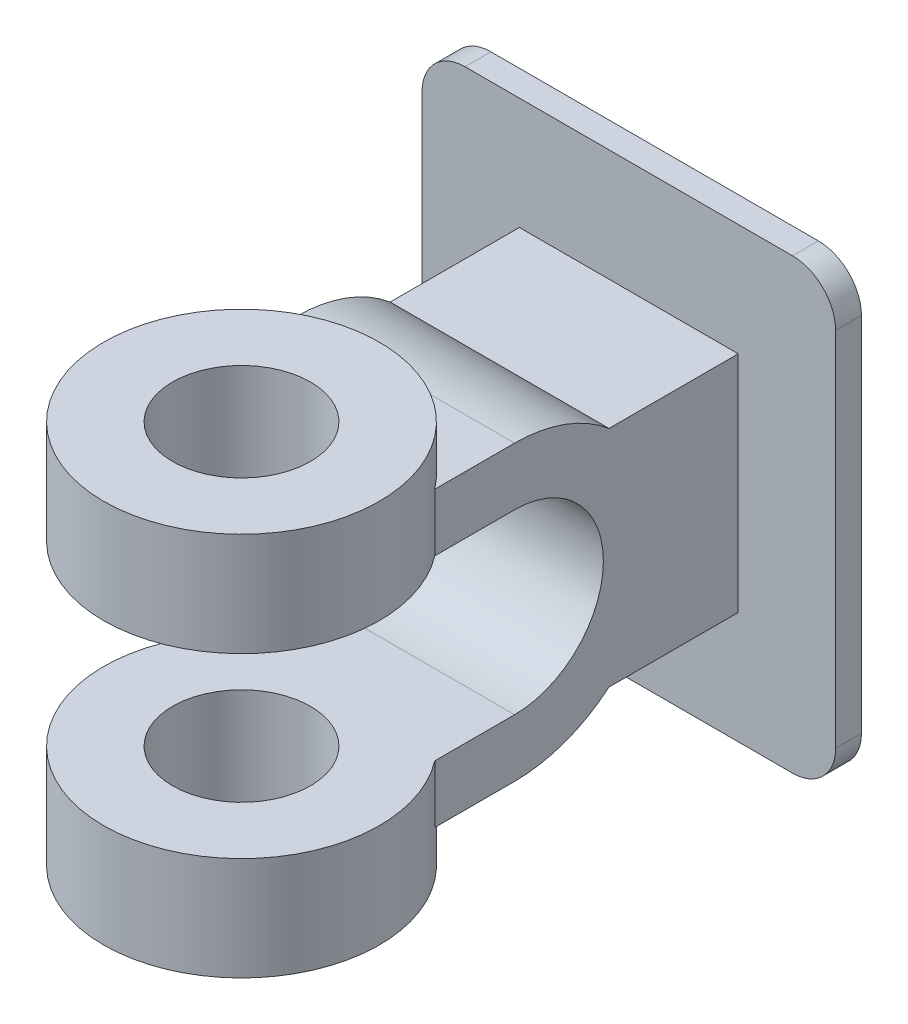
SolidWorks part; units mm, degrees
ref_plane "Front Plane" through (0, 0, 0) normal (0, 0, 1) x (1, 0, 0)
ref_plane "Top Plane" through (0, 0, 0) normal (0, 1, 0) x (1, 0, 0)
ref_plane "Right Plane" through (0, 0, 0) normal (1, 0, 0) x (0, 0, -1)
sketch "Sketch1" plane through (0, 0, 0) normal (1, 0, 0) x (0, 0, -1)
  line L0 (-19, 10.3) -> (-19, -17) construction
  line L1 (10.9545, 13) -> (25.9545, 13)
  line L3 (10.9545, -13) -> (25.9545, -13)
  line L4 (25.9545, 13) -> (25.9545, -13)
  line L5 (0, 17) -> (-19, 17)
  line L9 (25.9545, 2) -> (26.6958, 2) construction
  line L10 (0, -17) -> (-19, -17)
  line L11 (0, 10.3) -> (-19, 10.3)
  line L12 (-19, 10.3) -> (-19, 17)
  line L13 (0, -10.3) -> (-19, -10.3)
  line L14 (-19, -10.3) -> (-19, -17)
  line L15 (0, 0) -> (25.9545, 0) construction
  arc A1 (0, -10.3) -> (0, 10.3) centre (0, 0) ccw
  arc A2 (0, -17) -> (10.9545, -13) centre (0, 0) ccw
  arc A3 (10.9545, 13) -> (0, 17) centre (0, 0) ccw
  point P14 (18.4545, -13)
  dimension "D1" = 15
  dimension "D2" = 20.6
  dimension "D5" = 17
  dimension "D3" = 13
  dimension "D4" = 19
  dimension "D6" = 13
extrude "Boss-Extrude1" add sketch "Sketch1" along normal mid plane 25.4
sketch "Sketch2" plane through (0, -10.3, 0) normal (0, 1, 0) x (1, 0, 0)
  line L0 (12.7, -19) -> (-12.7, -19) construction
  circle A0 centre (0, -19) radius 16
  dimension "D1" = 32
extrude "Boss-Extrude2" add sketch "Sketch2" against normal blind 12
sketch "Sketch3" plane through (0, -10.3, 0) normal (0, 1, 0) x (1, 0, 0)
  line L0 (12.7, -19) -> (-12.7, -19) construction
  circle A0 centre (0, -19) radius 8
  dimension "D1" = 16
extrude "Cut-Extrude1" cut sketch "Sketch3" against normal blind 26
mirror "Mirror2" about plane through (0, 0, 0) normal (0, 1, 0) of "Cut-Extrude1", "Boss-Extrude2"
sketch "Sketch4" plane through (0, 0, -25.9545) normal (0, 0, -1) x (-1, 0, 0)
  line L1 (-24, -26) -> (24, -26)
  line L2 (-24, -26) -> (-24, 26)
  line L3 (-24, 26) -> (24, 26)
  line L4 (24, -26) -> (24, 26)
  line L5 (-24, -26) -> (24, 26) construction
  line L6 (-24, 26) -> (24, -26) construction
  point P0 (0, 0)
  dimension "D1" = 52
  dimension "D2" = 48
extrude "Boss-Extrude3" add sketch "Sketch4" along normal blind 3
fillet "Fillet1" radius 5 4 edges at (-24, -26, -27.4545) (24, -26, -27.4545) (24, 26, -27.4545) (-24, 26, -27.4545)
scale "Scale1" scale about centroid uniform scaling yes scale factor 0.7
scale "Scale2" scale about centroid uniform scaling yes scale factor 0.5
scale "Scale3" scale about centroid uniform scaling yes scale factor 1.25
